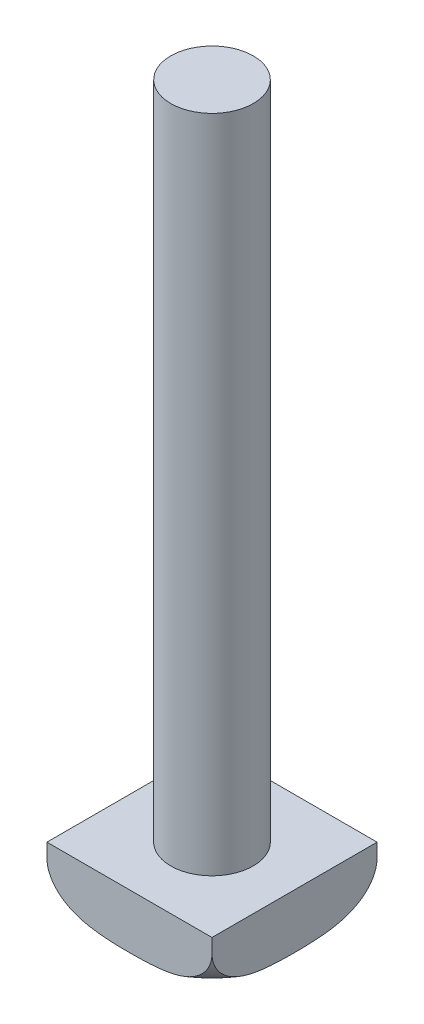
SolidWorks part; units mm, degrees
ref_plane "Front" through (0, 0, 0) normal (0, 0, 1) x (1, 0, 0)
ref_plane "Top" through (0, 0, 0) normal (0, 1, 0) x (1, 0, 0)
ref_plane "Right" through (0, 0, 0) normal (1, 0, 0) x (0, 0, -1)
sketch "Sketch1" plane through (0, 0, 0) normal (0, 1, 0) x (1, 0, 0)
  circle A0 centre (0, 0) radius 6
  dimension "D1" = 12
extrude "Extrude1" add sketch "Sketch1" along normal blind 96
sketch "Sketch2" plane through (0, 0, 0) normal (0, 1, 0) x (1, 0, 0)
  line L0 (12, -12) -> (-12, 12) construction
  line L1 (-12, 12) -> (12, 12)
  line L2 (-12, 12) -> (-12, -12)
  line L3 (-12, -12) -> (12, -12)
  line L4 (12, 12) -> (12, -12)
  dimension "D1" = 24
extrude "Extrude2" add sketch "Sketch2" against normal blind 8
ref_plane "Plane2" through (0, 0, 0) normal (-0.7071, 0, 0.7071) x (-0.611, -0.5035, -0.611)
sketch "Sketch5" plane through (0, 0, 0) normal (-0.7071, 0, 0.7071) x (-0.611, -0.5035, -0.611)
  line L0 (4.0276, 6.9122) -> (-10.6353, 15.4561) construction
  line L1 (-10.6353, 15.4561) -> (-14.6629, 8.5439) construction
  line L4 (0, 0) -> (6.6069, 11.3387) construction
  line L5 (-48.3317, -82.9461) -> (0, 0) construction
  line L6 (-4.8939, 12.0676) -> (-3.5098, 14.443)
  line L7 (-3.5098, 14.443) -> (-10.4738, 18.5008)
  line L8 (-10.4738, 18.5008) -> (-14.8599, 10.9734)
  line L9 (-14.8599, 10.9734) -> (-13.656, 10.272)
  arc A0 (-4.8939, 12.0676) -> (-13.656, 10.272) centre (-8.4719, 7.2512) ccw
  dimension "D1" = 6
revolve "Cut-Revolve1" cut sketch "Sketch5" angle 360 about L4
